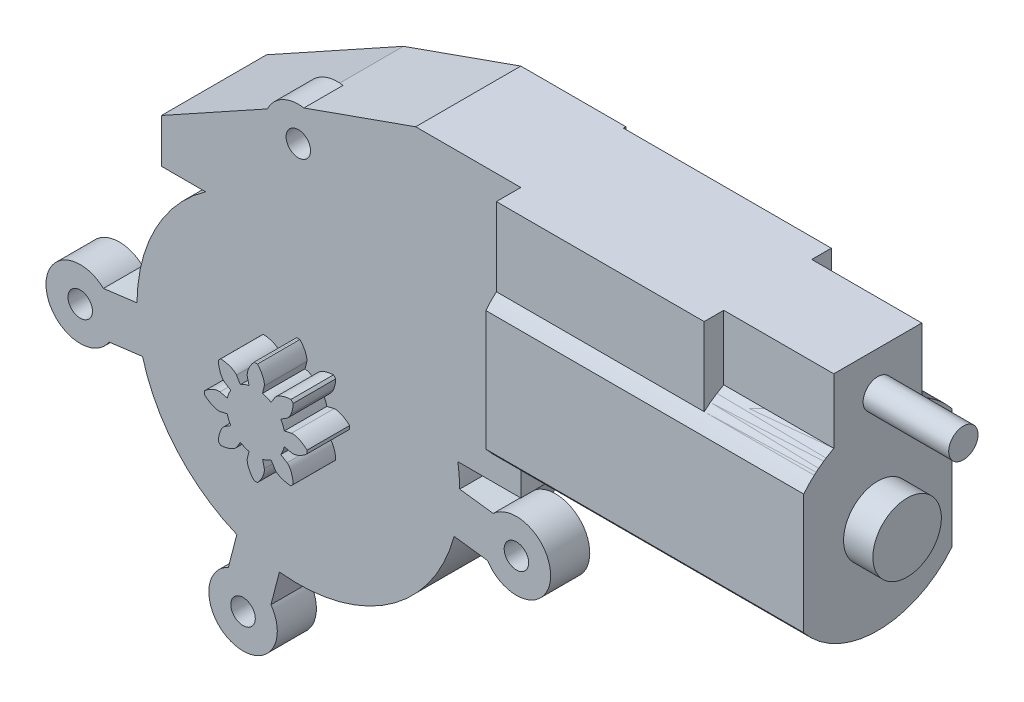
SolidWorks part; units mm, degrees
ref_plane "正面" through (0, 0, 0) normal (0, 0, 1) x (1, 0, 0)
ref_plane "平面" through (0, 0, 0) normal (0, 1, 0) x (1, 0, 0)
ref_plane "右側面" through (0, 0, 0) normal (1, 0, 0) x (0, 0, -1)
ref_plane "平面1" through (0, 0, 16.7) normal (0, 0, 1) x (1, 0, 0)
sketch "ｽｹｯﾁ1" plane through (0, 0, 16.7) normal (0, 0, 1) x (1, 0, 0)
  line L0 (7.1677, 5) -> (15.3548, 5)
  line L1 (15.3548, 5) -> (15.3548, 60)
  line L2 (15.3548, 60) -> (-28, 36)
  line L3 (-28, 36) -> (-28, 10.5)
  line L4 (-28, 10.5) -> (0, 10.5)
  line L5 (-1.7431, 7.3127) -> (-1.3912, 5.8365)
  line L6 (5.1108, 3.1433) -> (6.4034, 3.9383)
  arc A0 (0, 10.5) -> (-0.3326, 10.4947) centre (0, 0) ccw
  arc A1 (-1.3912, 5.8365) -> (5.1108, 3.1433) centre (0, 0) ccw
  ellipse E0 centre (0.9526, 9.1569) end of major axis (-1.37, 6.5175) minor radius 1.8504 (-0.3326, 10.4947) -> (-1.7431, 7.3127) ccw
  ellipse E1 centre (6.7022, 5.0269) end of major axis (6.1121, 3.8673) minor radius 0.4316 (6.4034, 3.9383) -> (7.1677, 5) ccw
  point P8 (0.9526, 9.1569)
  point P9 (2.3417, 7.9345)
  point P10 (-1.37, 6.5175)
  point P11 (-0.3326, 10.4947)
  point P12 (-1.7431, 7.3127)
  point P13 (-1.3476, 9.0318)
  point P14 (3.2527, 9.282)
  point P24 (6.7022, 5.0269)
  point P25 (7.0868, 4.8312)
  point P26 (6.1121, 3.8673)
  point P27 (6.4034, 3.9383)
  point P28 (7.1677, 5)
  point P29 (6.8467, 4.4241)
  point P30 (6.5577, 5.6298)
extrude "ﾎﾞｽ - 押し出し1" add sketch "ｽｹｯﾁ1" against normal blind 8.7
sketch "ｽｹｯﾁ2" plane through (15.3548, 0, 0) normal (1, 0, 0) x (0, 0, -1)
  line L0 (-8, 60) -> (-8, 5)
  line L1 (-8, 5) -> (-16.7, 5)
  line L2 (-16.7, 5) -> (-16.7, 60)
  line L3 (-16.7, 60) -> (-8, 60)
extrude "ﾎﾞｽ - 押し出し2" add sketch "ｽｹｯﾁ2" along normal blind 30.1452
sketch "ｽｹｯﾁ3" plane through (0, 0, 8) normal (0, 0, -1) x (-1, 0, 0)
  line L0 (-32.619, 5) -> (-45.5, 5)
  line L1 (-45.5, 5) -> (-45.5, 60)
  line L2 (-45.5, 60) -> (-15.3548, 60)
  line L3 (-15.3548, 60) -> (28, 36)
  line L4 (28, 36) -> (28, 17.4642)
  arc A0 (28, 17.4642) -> (-32.619, 5) centre (0, 0) cw
extrude "ﾎﾞｽ - 押し出し3" add sketch "ｽｹｯﾁ3" along normal blind 17
sketch "ｽｹｯﾁ4" plane through (0, 10.5, 0) normal (0, -1, 0) x (1, 0, 0)
  line L0 (-28, 16.7) -> (-28, 8)
  line L1 (-28, 8) -> (-3, 8)
  line L2 (-3, 8) -> (-3, 16.7)
  line L3 (-3, 16.7) -> (-28, 16.7)
  dimension "D1" = 25
extrude "ｶｯﾄ - 押し出し11" cut sketch "ｽｹｯﾁ4" against normal through all
sketch "ｽｹｯﾁ5" plane through (0, 0, 16.7) normal (0, 0, 1) x (1, 0, 0)
  line L0 (0, 10.5) -> (-0.3326, 10.4947)
  line L1 (1.7431, 7.3127) -> (1.3912, 5.8365)
  line L2 (3.1433, 5.1108) -> (3.9383, 6.4034)
  line L3 (-0.3326, 10.4947) -> (-3, 10.5)
  line L4 (-3, 10.5) -> (-3, 49.8393)
  line L5 (-3, 49.8393) -> (15.3548, 60)
  line L6 (15.3548, 60) -> (45.5, 60)
  line L7 (45.5, 60) -> (45.5, 5)
  line L8 (45.5, 5) -> (7.1677, 5)
  arc A0 (0, 10.5) -> (0.3326, 10.4947) centre (0, 0) cw
  arc A1 (1.3912, 5.8365) -> (3.1433, 5.1108) centre (0, 0) cw
  arc A2 (7.1857, 7.6561) -> (7.6561, 7.1857) centre (0, 0) cw
  arc A3 (7.6561, 7.1857) -> (7.1677, 5) centre (1.7034, 7.3685) cw
  ellipse E0 centre (-0.9523, 9.1569) end of major axis (-3.2747, 11.7962) minor radius 1.8503 (1.7431, 7.3127) -> (0.3326, 10.4947) ccw
  ellipse E1 centre (7.2071, 5.7532) end of major axis (3.6305, 5.5642) minor radius 1.9018 (7.1857, 7.6561) -> (3.9383, 6.4034) ccw
  point P4 (-0.9523, 9.1569)
  point P5 (0.4368, 10.3791)
  point P6 (-3.2747, 11.7962)
  point P7 (1.7431, 7.3127)
  point P8 (0.3326, 10.4947)
  point P9 (1.3477, 9.0316)
  point P10 (-3.2523, 9.2821)
  point P20 (7.2071, 5.7532)
  point P21 (10.7836, 5.9422)
  point P22 (7.1067, 7.6524)
  point P23 (7.1857, 7.6561)
  point P24 (3.9383, 6.4034)
  point P25 (5.4334, 7.3393)
  point P26 (8.9808, 4.1671)
extrude "ｶｯﾄ - 押し出し16" cut sketch "ｽｹｯﾁ5" against normal blind 8.7
ref_plane "平面2" through (0, 17.4642, 0) normal (0, -1, 0) x (1, 0, 0)
sketch "ｽｹｯﾁ7" plane through (0, 0, -9) normal (0, 0, -1) x (-1, 0, 0)
  line L0 (28, 36) -> (28, 5)
  line L1 (28, 5) -> (-45.5, 5)
  line L2 (-45.5, 5) -> (-45.5, 60)
  line L3 (-45.5, 60) -> (-15.3548, 60)
  line L4 (-15.3548, 60) -> (28, 36)
extrude "ﾎﾞｽ - 押し出し4" add sketch "ｽｹｯﾁ7" along normal blind 4.5
sketch "ｽｹｯﾁ9" plane through (45.5, 0, 0) normal (1, 0, 0) x (0, 0, -1)
  line L0 (15.15, 41.7771) -> (15.15, 17.2229)
  line L1 (-15.15, 17.2229) -> (-15.15, 41.7771)
  line L2 (-13, 44.0344) -> (-13, 60)
  line L3 (-13, 60) -> (13, 60)
  line L4 (13, 60) -> (13, 44.0344)
  arc A0 (13, 44.0344) -> (15.15, 41.7771) centre (0, 29.5) cw
  arc A1 (15.15, 17.2229) -> (-15.15, 17.2229) centre (0, 29.5) cw
  arc A2 (-15.15, 41.7771) -> (-13, 44.0344) centre (0, 29.5) cw
extrude "ﾎﾞｽ - 押し出し5" add sketch "ｽｹｯﾁ9" along normal blind 65
sketch "ｽｹｯﾁ10" plane through (0, 0, 8) normal (0, 0, 1) x (1, 0, 0)
  line L0 (-3.9383, 6.4034) -> (-3.1433, 5.1108)
  line L1 (-5.1108, 3.1433) -> (-6.4034, 3.9383)
  arc A0 (-7.6561, 7.1857) -> (-7.1857, 7.6561) centre (0, 0) cw
  arc A1 (-3.1433, 5.1108) -> (-5.1108, 3.1433) centre (0, 0) ccw
  ellipse E0 centre (-5.8013, 7.1485) end of major axis (-5.5773, 3.6398) minor radius 1.8504 (-7.6561, 7.1857) -> (-6.4034, 3.9383) ccw
  ellipse E1 centre (-7.2072, 5.7531) end of major axis (-3.6305, 5.5642) minor radius 1.902 (-3.9383, 6.4034) -> (-7.1857, 7.6561) ccw
  point P0 (-5.8013, 7.1485)
  point P1 (-3.9547, 7.2664)
  point P2 (-5.5773, 3.6398)
  point P3 (-7.6561, 7.1857)
  point P4 (-6.4034, 3.9383)
  point P5 (-7.3393, 5.4335)
  point P6 (-4.2634, 8.8634)
  point P16 (-7.2072, 5.7531)
  point P17 (-3.6305, 5.5642)
  point P18 (-7.3075, 3.8537)
  point P19 (-3.9383, 6.4034)
  point P20 (-7.1857, 7.6561)
  point P21 (-5.4335, 7.3393)
  point P22 (-8.9809, 4.1668)
extrude "ﾎﾞｽ - 押し出し6" add sketch "ｽｹｯﾁ10" along normal blind 8.7
sketch "ｽｹｯﾁ11" plane through (0, 0, 8) normal (0, 0, 1) x (1, 0, 0)
  line L0 (-7.3127, 1.7431) -> (-5.8365, 1.3912)
  line L1 (-5.8365, -1.3912) -> (-7.3127, -1.7431)
  arc A0 (-10.4947, -0.3326) -> (-10.4947, 0.3326) centre (0, 0) cw
  arc A1 (-5.8365, 1.3912) -> (-5.8365, -1.3912) centre (0, 0) ccw
  ellipse E0 centre (-9.1569, 0.9526) end of major axis (-6.5175, -1.37) minor radius 1.8504 (-10.4947, -0.3326) -> (-7.3127, -1.7431) ccw
  ellipse E1 centre (-9.1643, -1.0282) end of major axis (-6.5016, 1.3673) minor radius 1.902 (-7.3127, 1.7431) -> (-10.4947, 0.3326) ccw
  point P0 (-9.1569, 0.9526)
  point P1 (-6.5175, -1.37)
  point P2 (-10.3793, -0.4366)
  point P3 (-10.4947, -0.3326)
  point P4 (-7.3127, -1.7431)
  point P5 (-9.0318, -1.3476)
  point P6 (-9.282, 3.2527)
  point P16 (-9.1643, -1.0282)
  point P17 (-6.5016, 1.3673)
  point P18 (-7.8922, -2.4422)
  point P19 (-7.3127, 1.7431)
  point P20 (-10.4947, 0.3326)
  point P21 (-9.0318, 1.3476)
  point P22 (-9.2969, -3.4041)
extrude "ﾎﾞｽ - 押し出し7" add sketch "ｽｹｯﾁ11" along normal blind 8.7
sketch "ｽｹｯﾁ12" plane through (0, 0, 8) normal (0, 0, 1) x (1, 0, 0)
  line L0 (-6.4034, -3.9383) -> (-5.1108, -3.1433)
  line L1 (-3.1433, -5.1108) -> (-3.9383, -6.4034)
  arc A0 (-7.1857, -7.6561) -> (-7.6561, -7.1857) centre (0, 0) cw
  arc A1 (-5.1108, -3.1433) -> (-3.1433, -5.1108) centre (0, 0) ccw
  ellipse E0 centre (-7.1485, -5.8013) end of major axis (-10.6571, -6.0254) minor radius 1.8504 (-7.1857, -7.6561) -> (-3.9383, -6.4034) ccw
  ellipse E1 centre (-5.7531, -7.2072) end of major axis (-5.9419, -10.784) minor radius 1.902 (-6.4034, -3.9383) -> (-7.6561, -7.1857) ccw
  point P0 (-7.1485, -5.8013)
  point P1 (-3.6398, -5.5773)
  point P2 (-7.0305, -7.648)
  point P3 (-7.1857, -7.6561)
  point P4 (-3.9383, -6.4034)
  point P5 (-5.4335, -7.3393)
  point P6 (-8.8634, -4.2634)
  point P16 (-5.7531, -7.2072)
  point P17 (-3.8537, -7.3075)
  point P18 (-5.9419, -10.784)
  point P19 (-6.4034, -3.9383)
  point P20 (-7.6561, -7.1857)
  point P21 (-7.3393, -5.4335)
  point P22 (-4.1668, -8.9809)
extrude "ﾎﾞｽ - 押し出し8" add sketch "ｽｹｯﾁ12" along normal blind 8.7
sketch "ｽｹｯﾁ13" plane through (0, 0, 8) normal (0, 0, 1) x (1, 0, 0)
  line L0 (-1.7431, -7.3127) -> (-1.3912, -5.8365)
  line L1 (1.3912, -5.8365) -> (1.7431, -7.3127)
  arc A0 (0.3326, -10.4947) -> (-0.3326, -10.4947) centre (0, 0) cw
  arc A1 (-1.3912, -5.8365) -> (1.3912, -5.8365) centre (0, 0) ccw
  ellipse E0 centre (-0.9526, -9.1569) end of major axis (-3.2751, -11.7963) minor radius 1.8504 (0.3326, -10.4947) -> (1.7431, -7.3127) ccw
  ellipse E1 centre (1.0282, -9.1643) end of major axis (3.4238, -11.827) minor radius 1.902 (-1.7431, -7.3127) -> (-0.3326, -10.4947) ccw
  point P0 (-0.9526, -9.1569)
  point P1 (0.4366, -10.3793)
  point P2 (-3.2751, -11.7963)
  point P3 (0.3326, -10.4947)
  point P4 (1.7431, -7.3127)
  point P5 (1.3476, -9.0318)
  point P6 (-3.2527, -9.282)
  point P16 (1.0282, -9.1643)
  point P17 (2.4422, -7.8922)
  point P18 (3.4238, -11.827)
  point P19 (-1.7431, -7.3127)
  point P20 (-0.3326, -10.4947)
  point P21 (-1.3476, -9.0318)
  point P22 (3.4041, -9.2969)
extrude "ﾎﾞｽ - 押し出し9" add sketch "ｽｹｯﾁ13" along normal blind 8.7
sketch "ｽｹｯﾁ14" plane through (0, 0, 8) normal (0, 0, 1) x (1, 0, 0)
  line L0 (5.1108, -3.1433) -> (6.4034, -3.9383)
  line L1 (3.9383, -6.4034) -> (3.1433, -5.1108)
  arc A0 (3.1433, -5.1108) -> (5.1108, -3.1433) centre (0, 0) ccw
  arc A1 (7.6561, -7.1857) -> (7.1857, -7.6561) centre (0, 0) cw
  ellipse E0 centre (5.8013, -7.1485) end of major axis (6.0254, -10.6571) minor radius 1.8504 (7.6561, -7.1857) -> (6.4034, -3.9383) ccw
  ellipse E1 centre (7.2072, -5.7531) end of major axis (10.784, -5.9419) minor radius 1.902 (3.9383, -6.4034) -> (7.1857, -7.6561) ccw
  point P4 (5.8013, -7.1485)
  point P5 (7.648, -7.0305)
  point P6 (6.0254, -10.6571)
  point P7 (7.6561, -7.1857)
  point P8 (6.4034, -3.9383)
  point P9 (7.3393, -5.4335)
  point P10 (4.2634, -8.8634)
  point P18 (7.2072, -5.7531)
  point P19 (10.784, -5.9419)
  point P20 (7.1069, -7.6524)
  point P21 (3.9383, -6.4034)
  point P22 (7.1857, -7.6561)
  point P23 (5.4335, -7.3393)
  point P24 (8.9809, -4.1668)
extrude "ﾎﾞｽ - 押し出し10" add sketch "ｽｹｯﾁ14" along normal blind 8.7
sketch "ｽｹｯﾁ15" plane through (0, 0, 8) normal (0, 0, 1) x (1, 0, 0)
  line L0 (5.8365, 1.3912) -> (7.3127, 1.7431)
  line L1 (7.3127, -1.7431) -> (5.8365, -1.3912)
  arc A0 (5.8365, -1.3912) -> (5.8365, 1.3912) centre (0, 0) ccw
  arc A1 (10.4947, 0.3326) -> (10.4947, -0.3326) centre (0, 0) cw
  ellipse E0 centre (9.1569, -0.9526) end of major axis (11.7963, -3.2751) minor radius 1.8504 (10.4947, 0.3326) -> (7.3127, 1.7431) ccw
  ellipse E1 centre (9.1643, 1.0282) end of major axis (11.827, 3.4238) minor radius 1.902 (7.3127, -1.7431) -> (10.4947, -0.3326) ccw
  point P4 (9.1569, -0.9526)
  point P5 (11.7963, -3.2751)
  point P6 (7.9345, -2.3417)
  point P7 (10.4947, 0.3326)
  point P8 (7.3127, 1.7431)
  point P9 (9.0318, 1.3476)
  point P10 (9.282, -3.2527)
  point P18 (9.1643, 1.0282)
  point P19 (11.827, 3.4238)
  point P20 (10.4364, -0.3857)
  point P21 (7.3127, -1.7431)
  point P22 (10.4947, -0.3326)
  point P23 (9.0318, -1.3476)
  point P24 (9.2969, 3.4041)
extrude "ﾎﾞｽ - 押し出し11" add sketch "ｽｹｯﾁ15" along normal blind 8.7
ref_plane "平面3" through (0, 0, 8) normal (0, 0, 1) x (1, 0, 0)
sketch "ｽｹｯﾁ16" plane through (0, 0, 8) normal (0, 0, 1) x (1, 0, 0)
  line L0 (-38.7109, -9.484) -> (-31.8575, -8.6081)
  line L1 (-32.9985, 0.3193) -> (-39.8518, -0.5566)
  arc A0 (-39.8518, -0.5566) -> (-38.7109, -9.484) centre (-44.6, -5.7) ccw
  arc A1 (-31.8575, -8.6081) -> (-32.9985, 0.3193) centre (0, 0) cw
extrude "ﾎﾞｽ - 押し出し12" add sketch "ｽｹｯﾁ16" against normal blind 8
sketch "ｽｹｯﾁ17" plane through (0, 0, 8) normal (0, 0, 1) x (1, 0, 0)
  line L0 (-5.5964, -39.4418) -> (-3.8641, -32.773)
  line L1 (-12.575, -30.5102) -> (-14.3073, -37.1789)
  arc A0 (-14.3073, -37.1789) -> (-5.5964, -39.4418) centre (-11.3, -43.5) ccw
  arc A1 (-3.8641, -32.773) -> (-12.575, -30.5102) centre (0, 0) cw
extrude "ﾎﾞｽ - 押し出し13" add sketch "ｽｹｯﾁ17" against normal blind 8
sketch "ｽｹｯﾁ18" plane through (0, 0, 8) normal (0, 0, 1) x (1, 0, 0)
  line L0 (39.8518, -0.5566) -> (32.9985, 0.3193)
  line L1 (31.8575, -8.6081) -> (38.7109, -9.484)
  arc A0 (38.7109, -9.484) -> (39.8518, -0.5566) centre (44.6, -5.7) ccw
  arc A1 (32.9985, 0.3193) -> (31.8575, -8.6081) centre (0, 0) cw
extrude "ﾎﾞｽ - 押し出し14" add sketch "ｽｹｯﾁ18" against normal blind 8
sketch "ｽｹｯﾁ19" plane through (-28, 0, 0) normal (-1, 0, 0) x (0, 0, 1)
  line L0 (-13.5, 27) -> (-13.5, 5)
  line L1 (-13.5, 5) -> (-9, 5)
  line L2 (-9, 5) -> (-9, 27)
  line L3 (-9, 27) -> (-13.5, 27)
extrude "ｶｯﾄ - 押し出し5" cut sketch "ｽｹｯﾁ19" against normal blind 28
imported_body "ｻｰﾌｪｽ-ｲﾝﾎﾟｰﾄ1"
sketch "ｽｹｯﾁ20" plane through (0, 60, 0) normal (0, 1, 0) x (-1, 0, 0)
  line L0 (-88, -13) -> (-88, -9)
  line L1 (-88, -9) -> (-110.5, -9)
  line L2 (-110.5, -9) -> (-110.5, -13)
  line L3 (-110.5, -13) -> (-88, -13)
extrude "ｶｯﾄ - 押し出し6" cut sketch "ｽｹｯﾁ20" against normal up to surface
imported_body "ｻｰﾌｪｽ-ｲﾝﾎﾟｰﾄ2"
sketch "ｽｹｯﾁ21" plane through (0, 60, 0) normal (0, 1, 0) x (-1, 0, 0)
  line L0 (-110.5, 9) -> (-88, 9)
  line L1 (-88, 9) -> (-88, 13)
  line L2 (-88, 13) -> (-110.5, 13)
  line L3 (-110.5, 13) -> (-110.5, 9)
extrude "ｶｯﾄ - 押し出し7" cut sketch "ｽｹｯﾁ21" against normal up to surface
sketch "ｽｹｯﾁ22" plane through (0, 0, 8) normal (0, 0, 1) x (1, 0, 0)
  line L0 (-6.3253, 47.9985) -> (0.8168, 51.9522)
  arc A0 (0.8168, 51.9522) -> (-6.3253, 47.9985) centre (0, 45) ccw
extrude "ﾎﾞｽ - 押し出し15" add sketch "ｽｹｯﾁ22" against normal blind 8
ref_plane "平面4" through (0, 0, 0) normal (0, 0, -1) x (-1, 0, 0)
sketch "ｽｹｯﾁ23" plane through (0, 0, 0) normal (0, 0, -1) x (-1, 0, 0)
  line L0 (-128, 55) -> (-128, 52)
  line L1 (-128, 52) -> (-110.5, 52)
  line L2 (-110.5, 52) -> (-110.5, 55)
  line L3 (-110.5, 55) -> (-128, 55)
  line L4 (-128, 52) -> (-110.5, 52) construction
revolve "回転1" add sketch "ｽｹｯﾁ23" angle 360 about L4
sketch "ｽｹｯﾁ24" plane through (0, 0, 0) normal (0, 0, -1) x (-1, 0, 0)
  line L0 (-116.5, 36.5) -> (-116.5, 29.5)
  line L1 (-116.5, 29.5) -> (-110.5, 29.5)
  line L2 (-110.5, 29.5) -> (-110.5, 36.5)
  line L3 (-110.5, 36.5) -> (-116.5, 36.5)
  line L4 (-116.5, 29.5) -> (-110.5, 29.5) construction
revolve "回転2" add sketch "ｽｹｯﾁ24" angle 360 about L4
hole_wizard "Ø5.0 (5) 直径の穴1" positions "ｽｹｯﾁ26" profile "ｽｹｯﾁ25" hole size "Ø5.0" standard "Ansi Metric"
sketch "ｽｹｯﾁ26" plane through (0, 0, 0) normal (0, 0, -1) x (-1, 0, 0)
  point P0 (-44.6, -5.7)
  point P1 (44.6, -5.7)
  point P2 (11.3, -43.5)
sketch "ｽｹｯﾁ25" plane through (44.6, -5.7, 0) normal (1, 0, 0) x (0, 1, 0)
  line L0 (0, 0) -> (0, 16.7)
  line L1 (0, 16.7) -> (2.5, 16.7)
  line L2 (2.5, 16.7) -> (2.5, 0)
  line L5 (2.5, 0) -> (0, 0)
  line L11 (0, -6.35) -> (0, 107.95) construction
  dimension "通し穴の直径" = 5
  dimension "通し穴の深さ" = 16.7
hole_wizard "Ø5.0 (5) 直径の穴2" positions "ｽｹｯﾁ28" profile "ｽｹｯﾁ27" hole size "Ø5.0" standard "Ansi Metric"
sketch "ｽｹｯﾁ28" plane through (0, 0, -13.5) normal (0, 0, -1) x (-1, 0, 0)
  point P0 (0, 45)
sketch "ｽｹｯﾁ27" plane through (0, 45, -13.5) normal (1, 0, 0) x (0, 1, 0)
  line L0 (0, 0) -> (0, 21.5)
  line L1 (0, 21.5) -> (2.5, 21.5)
  line L2 (2.5, 21.5) -> (2.5, 0)
  line L5 (2.5, 0) -> (0, 0)
  line L11 (0, -6.35) -> (0, 107.95) construction
  dimension "通し穴の直径" = 5
  dimension "通し穴の深さ" = 21.5
chamfer "面取り1" distance 17.5505 angle 9.465 1 edges at (15.3548, 60, -2.75)
sketch "ｽｹｯﾁ29" plane through (0, 0, -9) normal (0, 0, -1) x (-1, 0, 0)
  circle A0 centre (0, 0) radius 33
extrude "ﾎﾞｽ - 押し出し16" add sketch "ｽｹｯﾁ29" along normal blind 4.5
sketch "ｽｹｯﾁ30" plane through (0, 0, -9) normal (0, 0, -1) x (-1, 0, 0)
  line L0 (28, 27) -> (28, 17.4642)
  line L1 (28, 27) -> (18.9737, 27)
  arc A0 (18.9737, 27) -> (28, 17.4642) centre (0, 0) cw
extrude "ｶｯﾄ - 押し出し18" cut sketch "ｽｹｯﾁ30" against normal through all contours M3 M1 M2
